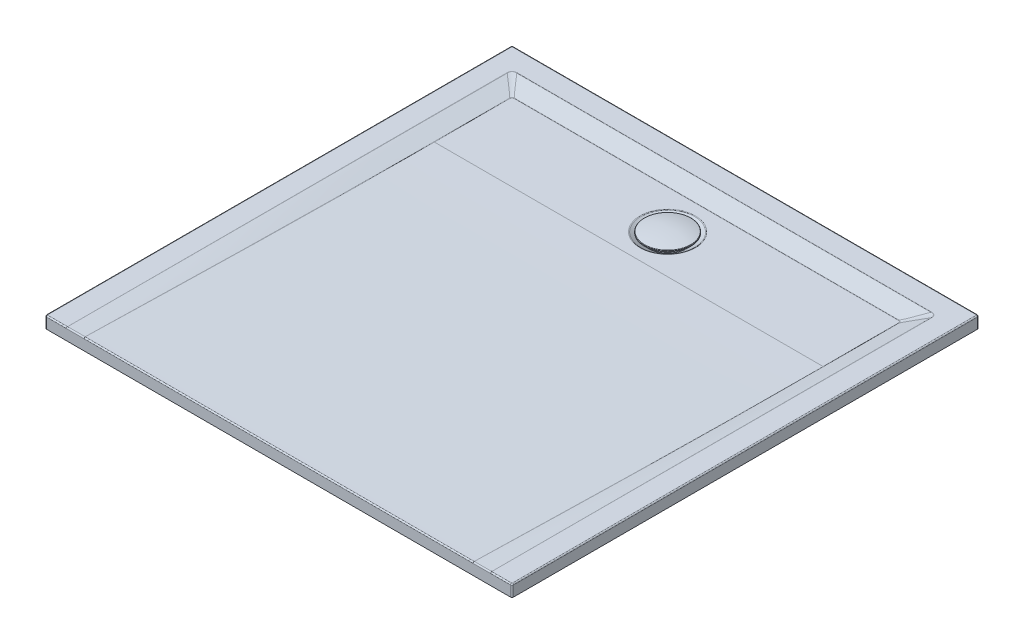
SolidWorks part; units mm, degrees
ref_plane "Płaszczyzna przednia" through (0, 0, 0) normal (0, 0, 1) x (1, 0, 0)
ref_plane "Płaszczyzna górna" through (0, 0, 0) normal (0, 1, 0) x (1, 0, 0)
ref_plane "Płaszczyzna prawa" through (0, 0, 0) normal (1, 0, 0) x (0, 0, -1)
sketch "Szkic1" plane through (0, 0, 0) normal (0, 1, 0) x (1, 0, 0)
  line L0 (0, 600) -> (0, -600) construction
  line L1 (-600, 600) -> (600, 600)
  line L2 (-600, 600) -> (-600, -600)
  line L3 (-600, -600) -> (600, -600)
  line L4 (600, 600) -> (600, -600)
  line L5 (-545, -600) -> (-545, 545)
  line L6 (-545, 545) -> (545, 545)
  line L7 (545, 545) -> (545, -600)
  line L8 (-500, -600) -> (-500, 500)
  line L9 (-500, 500) -> (500, 500)
  line L10 (500, 500) -> (500, -600)
  circle A0 centre (0, 400) radius 45
  circle A1 centre (0, 400) radius 70
  point P9 (0, 545)
  dimension "D6" = 90
  dimension "D7" = 140
  dimension "D1" = 1200
  dimension "D2" = 55
  dimension "D3" = 55
  dimension "D5" = 200
  dimension "D8" = 1200
  dimension "D4" = 45
sketch "Szkic2" plane through (0, 0, 0) normal (0, 1, 0) x (1, 0, 0)
  line L0 (-600, -600) -> (600, -600) construction
  line L1 (600, 600) -> (600, -600) construction
  line L2 (545, 545) -> (545, -600) construction
  line L3 (-545, 545) -> (545, 545) construction
  line L4 (-600, 600) -> (600, 600) construction
  line L5 (-545, -600) -> (-545, 545) construction
  line L6 (-600, 600) -> (-600, -600) construction
  line L7 (-600, -600) -> (-545, -600)
  line L8 (600, 600) -> (600, -600)
  line L9 (545, 545) -> (545, -600)
  line L10 (-545, 545) -> (545, 545)
  line L11 (-600, 600) -> (600, 600)
  line L12 (-545, -600) -> (-545, 545)
  line L13 (-600, 600) -> (-600, -600)
  line L14 (545, -600) -> (600, -600)
surface "Powierzchnia-Płaszczyzna1" sketch "Szkic2"
ref_plane "Płaszczyzna1" through (0, -15, 0) normal (0, 1, 0) x (-1, 0, 0)
sketch "Szkic3" plane through (0, -15, 0) normal (0, 1, 0) x (-1, 0, 0)
  line L0 (500, -300) -> (-500, -300)
  line L1 (500, 600) -> (500, -500) construction
  line L2 (-500, -500) -> (-500, 600) construction
  line L3 (0, -300) -> (0, -500) construction
  line L4 (500, -500) -> (-500, -500) construction
  line L5 (-500, -500) -> (-500, -300)
  line L6 (500, -300) -> (500, -500)
  line L7 (500, -500) -> (-500, -500)
  circle A0 centre (0, -400) radius 70 construction
  circle A1 centre (0, -400) radius 70
  point P10 (0, -400)
surface "Powierzchnia-Płaszczyzna2" sketch "Szkic3"
sketch "Szkic4" plane through (0, 0, 0) normal (0, 1, 0) x (1, 0, 0)
  line L0 (500, -600) -> (-500, -600)
other "Granica-Powierzchnia1"
other "Granica-Powierzchnia2"
other "Granica-Powierzchnia3"
mirror "Lustro1" about plane through (0, 0, 0) normal (1, 0, 0)
sketch "Szkic5" plane through (0, 0, 0) normal (0, 1, 0) x (1, 0, 0)
  line L0 (600, 600) -> (600, -600) construction
  line L1 (-600, 600) -> (600, 600) construction
  line L2 (-600, 600) -> (-600, -600) construction
  line L3 (-600, -600) -> (600, -600) construction
  line L4 (600, 600) -> (600, -600)
  line L5 (-600, 600) -> (600, 600)
  line L6 (-600, 600) -> (-600, -600)
  line L7 (-600, -600) -> (600, -600)
surface "Powierzchnia-Wyciągnięcie1" sketch "Szkic5" parameters "D1"=30
sketch "Szkic7" plane through (0, 0, 0) normal (1, 0, 0) x (0, 0, -1)
  line L0 (400, 0) -> (400, -30) construction
  line L1 (600, -30) -> (-600, -30) construction
  line L2 (445, -30) -> (445, -28)
  line L3 (445, -28) -> (449, -28)
  line L6 (449, -28) -> (470, -15)
  dimension "D1" = 90
  dimension "D2" = 2
  dimension "D3" = 98
surface "Powierzchnia-Obrót wokół linii środkowej1" sketch "Szkic7" parameters "D1"=360
surface "Powierzchnia-Płaszczyzna3"
surface "Powierzchnia-Połącz1"
fillet "Zaokrąglenie1" radius 4 6 edges at (0, -28, -449) (0, -15, -330) (600, -15, 600) (600, -15, -600) (-600, -15, -600) (-600, -15, 600)
fillet "Zmienne zaokrąglenie1" radius 40 2 edges at (522.5, -7.5, -522.5)
fillet "Zaokrąglenie3" radius 3 12 edges
fillet "Zaokrąglenie4" radius 3 12 edges at (-598.8284, 0, -598.8284) (0, 0, -600) (598.8284, 0, -598.8284) (600, 0, 0) (598.8284, 0, 598.8284) (570.5, 0, 600) (-570.5, 0, 600) (-598.8284, 0, 598.8284) (-600, 0, 0)
sketch "Szkic8" plane through (0, 0, 0) normal (1, 0, 0) x (0, 0, -1)
  line L0 (400, 0) -> (400, -30) construction
  line L1 (400, -5.6601) -> (179.8469, -5.6601) construction
  line L2 (460, -14.7573) -> (460, -17)
  line L3 (460, -17) -> (400, -17)
  line L4 (400, -17) -> (400, -5.6601)
  line L5 (400, -5.6601) -> (199.9922, 95.6514)
  arc A0 (400, -5.6601) -> (459.2694, -13.7943) centre (400, -225.6601) cw
  arc A1 (459.2694, -13.7943) -> (460, -14.7573) centre (459, -14.7573) cw
  point P11 (460, -14)
  dimension "D1" = 220
  dimension "D4" = 1
  dimension "D2" = 60
  dimension "D3" = 3
  dimension "D5" = 13
revolve "Obrót wokół linii środkowej1" add sketch "Szkic8" angle 360 about L4
